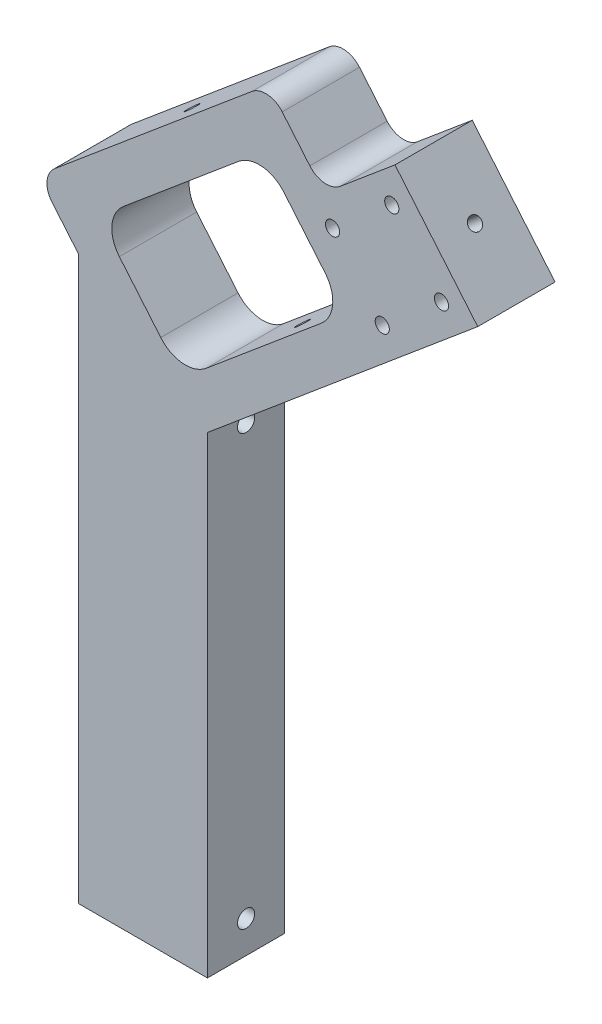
SolidWorks part; units mm, degrees
ref_plane "Plan de face" through (0, 0, 0) normal (0, 0, 1) x (1, 0, 0)
ref_plane "Plan de dessus" through (0, 0, 0) normal (0, 1, 0) x (1, 0, 0)
ref_plane "Plan de droite" through (0, 0, 0) normal (1, 0, 0) x (0, 0, -1)
sketch "Esquisse1" plane through (0, 0, 0) normal (0, 0, 1) x (1, 0, 0)
  line L0 (-74.9599, -139.9361) -> (-74.9599, 122.0104)
  line L1 (43.3191, 191.6254) -> (66.4595, 164.0478) construction
  line L2 (72.3758, 231.6717) -> (110.9431, 185.7091)
  line L3 (110.9431, 185.7091) -> (-14.9599, 80.0639)
  line L4 (-14.9599, 80.0639) -> (-14.9599, -139.9361)
  line L5 (-14.9599, -139.9361) -> (-74.9599, -139.9361)
  line L6 (66.4595, 164.0478) -> (94.0371, 187.1881) construction
  line L7 (-74.9599, 122.0104) -> (-87.3656, 136.795)
  line L8 (32.7364, 211.4643) -> (19.8806, 226.7852)
  line L9 (-86.133, 150.8833) -> (5.7923, 228.0178)
  line L10 (-15.5589, 105.6694) -> (38.0642, 150.6646)
  line L11 (-36.6914, 107.5183) -> (-55.975, 130.4996)
  line L12 (39.9131, 171.797) -> (20.6294, 194.7784)
  line L13 (-54.1262, 151.6321) -> (-0.503, 196.6272)
  line L14 (46.8247, 210.2318) -> (72.3758, 231.6717)
  line L15 (94.0371, 187.1881) -> (70.8967, 214.7657) construction
  line L16 (70.8967, 214.7657) -> (43.3191, 191.6254) construction
  arc A0 (-54.1262, 151.6321) -> (-55.975, 130.4996) centre (-44.4843, 140.1414) ccw
  arc A1 (-36.6914, 107.5183) -> (-15.5589, 105.6694) centre (-25.2007, 117.1601) ccw
  arc A2 (38.0642, 150.6646) -> (39.9131, 171.797) centre (28.4224, 162.1552) ccw
  arc A3 (20.6294, 194.7784) -> (-0.503, 196.6272) centre (9.1388, 185.1366) ccw
  arc A4 (19.8806, 226.7852) -> (5.7923, 228.0178) centre (12.2202, 220.3574) ccw
  arc A5 (-86.133, 150.8833) -> (-87.3656, 136.795) centre (-79.7051, 143.2228) ccw
  arc A6 (46.8247, 210.2318) -> (32.7364, 211.4643) centre (40.3968, 217.8922) cw
  circle A7 centre (43.3191, 191.6254) radius 3.3
  circle A8 centre (70.8967, 214.7657) radius 3.3
  circle A9 centre (94.0371, 187.1881) radius 3.3
  circle A10 centre (66.4595, 164.0478) radius 3.3
  point P27 (39.1643, 203.8039)
  dimension "D13" = 15
  dimension "D14" = 10
  dimension "D15" = 10
  dimension "D16" = 6.6
  dimension "D1" = 220
  dimension "D2" = 60
  dimension "D3" = 60
  dimension "D4" = 20
  dimension "D5" = 20
  dimension "D6" = 20
  dimension "D7" = 60
  dimension "D8" = 100
  dimension "D9" = 20
  dimension "D10" = 43.3546
  dimension "D11" = 1
  dimension "D12" = 130
  dimension "D17" = 36
  dimension "D18" = 36
  dimension "D19" = 12
  dimension "D20" = 12
extrude "Boss.-Extru.1" add sketch "Esquisse1" along normal mid plane 36
sketch "Esquisse2" plane through (-14.9599, 0, 0) normal (1, 0, 0) x (0, 0, -1)
  line L0 (-18, -139.9361) -> (18, -139.9361) construction
  circle A0 centre (0, -124.9361) radius 4
  circle A1 centre (0, 75.0639) radius 4
  dimension "D2" = 15
  dimension "D3" = 200
  dimension "D4" = 8
  dimension "D1" = 2
extrude "Enlèv. mat.-Extru.1" cut sketch "Esquisse2" against normal through all both and the other way through all
sketch "Esquisse3" plane through (-58.4606, 69.6706, 0) normal (-0.6428, 0.766, 0) x (0, 0, 1)
  line L0 (-25, 21.0042) -> (25, 161.0042) construction
  circle A0 centre (0, 91.0042) radius 3
  dimension "D1" = 6
extrude "Enlèv. mat.-Extru.2" cut sketch "Esquisse3" against normal through all both and the other way through all
sketch "Esquisse4" plane through (156.5479, 131.3593, 0) normal (0.766, 0.6428, 0) x (0.6428, -0.766, 0)
  line L0 (-130.9485, -18) -> (-70.9485, 18) construction
  circle A0 centre (-100.9485, 0) radius 3
  dimension "D1" = 6
extrude "Enlèv. mat.-Extru.3" cut sketch "Esquisse4" against normal blind 100
